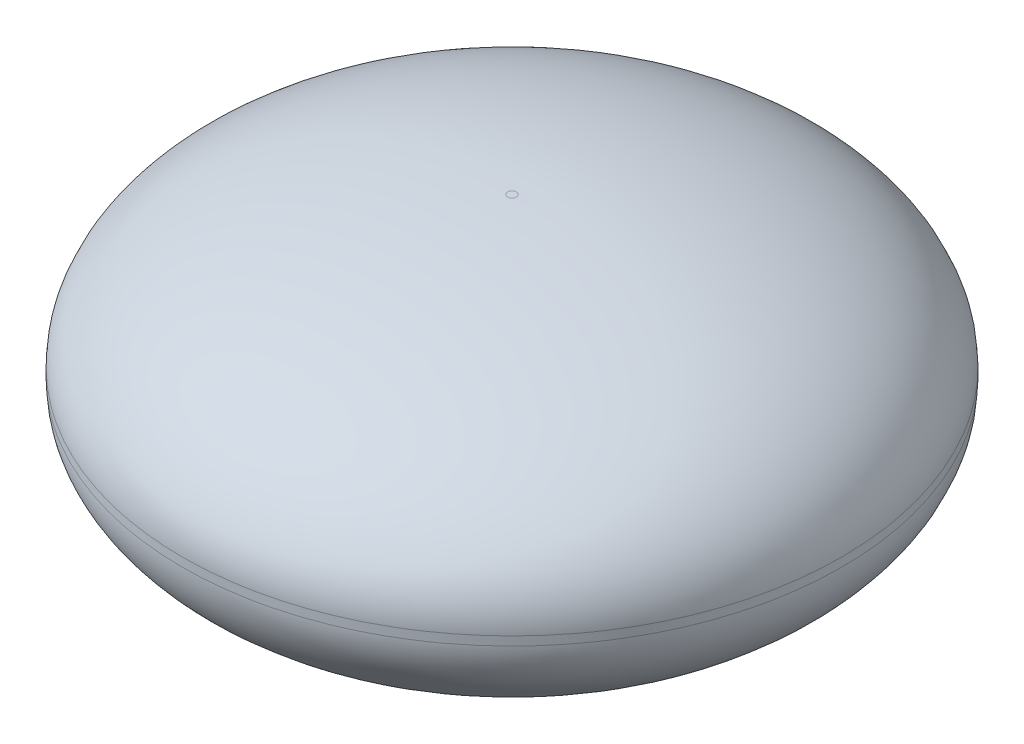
SolidWorks part; units mm, degrees
ref_plane "Front Plane" through (0, 0, 0) normal (0, 0, 1) x (1, 0, 0)
ref_plane "Top Plane" through (0, 0, 0) normal (0, 1, 0) x (1, 0, 0)
ref_plane "Right Plane" through (0, 0, 0) normal (1, 0, 0) x (0, 0, -1)
sketch "Sketch1" plane through (0, 0, 0) normal (0, 1, 0) x (1, 0, 0)
  circle A0 centre (0, 0) radius 7.5
  dimension "D1" = 15
extrude "Boss-Extrude1" add sketch "Sketch1" along normal blind 7
fillet "Fillet2" radius 3.4 1 edges at (0, 7, 7.5)
fillet "Fillet3" radius 3.4 1 edges at (0, 0, 7.5)
